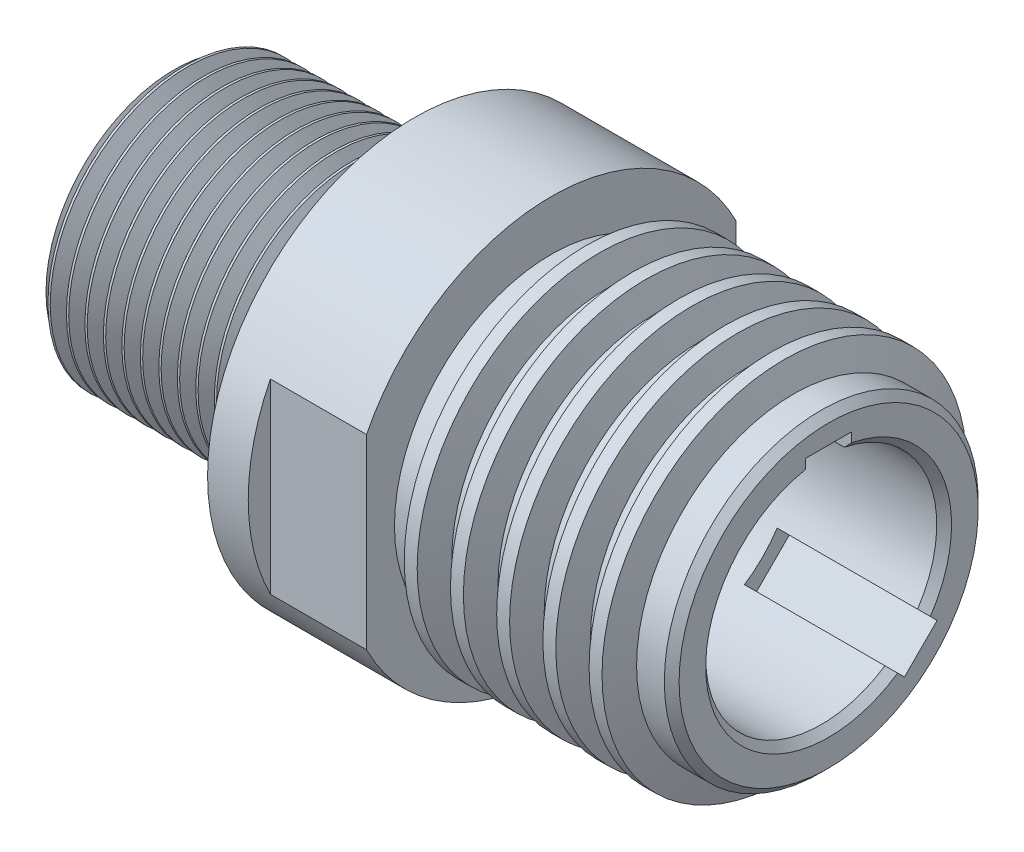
SolidWorks part; units mm, degrees
ref_plane "Front" through (0, 0, 0) normal (0, 0, 1) x (1, 0, 0)
ref_plane "Top" through (0, 0, 0) normal (0, 1, 0) x (1, 0, 0)
ref_plane "Right" through (0, 0, 0) normal (1, 0, 0) x (0, 0, -1)
sketch "Sketch1" plane through (0, 0, 0) normal (0, 0, 1) x (1, 0, 0)
  line L0 (0, 8.5725) -> (0.254, 8.5725)
  line L1 (0.254, 8.5725) -> (0.7526, 9.4361)
  line L2 (0.9113, 9.4361) -> (1.4099, 8.5725)
  line L3 (-0.8603, 0) -> (43.2496, 0) construction
  line L4 (1.4099, 8.5725) -> (1.524, 8.5725)
  line L5 (0.7526, 9.4361) -> (0.9113, 9.4361)
  line L6 (0, 8.5725) -> (0, 5.9724)
  line L7 (1.524, 8.5725) -> (2.0226, 9.4361)
  line L8 (2.0226, 9.4361) -> (2.1813, 9.4361)
  line L9 (2.1813, 9.4361) -> (2.6799, 8.5725)
  line L10 (2.6799, 8.5725) -> (2.794, 8.5725)
  line L11 (2.794, 8.5725) -> (3.2926, 9.4361)
  line L12 (3.2926, 9.4361) -> (3.4513, 9.4361)
  line L13 (3.4513, 9.4361) -> (3.9499, 8.5725)
  line L14 (3.9499, 8.5725) -> (4.064, 8.5725)
  line L15 (4.064, 8.5725) -> (4.5626, 9.4361)
  line L16 (4.5626, 9.4361) -> (4.7213, 9.4361)
  line L17 (4.7213, 9.4361) -> (5.2199, 8.5725)
  line L18 (5.2199, 8.5725) -> (5.334, 8.5725)
  line L19 (5.334, 8.5725) -> (5.8326, 9.4361)
  line L20 (5.8326, 9.4361) -> (5.9913, 9.4361)
  line L21 (5.9913, 9.4361) -> (6.4899, 8.5725)
  line L22 (6.4899, 8.5725) -> (6.604, 8.5725)
  line L23 (6.604, 8.5725) -> (7.1026, 9.4361)
  line L24 (7.1026, 9.4361) -> (7.2613, 9.4361)
  line L25 (7.2613, 9.4361) -> (7.7599, 8.5725)
  line L26 (7.7599, 8.5725) -> (7.874, 8.5725)
  line L27 (7.874, 8.5725) -> (8.3726, 9.4361)
  line L28 (8.3726, 9.4361) -> (8.5313, 9.4361)
  line L29 (8.5313, 9.4361) -> (9.0299, 8.5725)
  line L30 (9.0299, 8.5725) -> (9.144, 8.5725)
  line L31 (9.144, 8.5725) -> (9.6426, 9.4361)
  line L32 (9.6426, 9.4361) -> (9.8013, 9.4361)
  line L33 (9.8013, 9.4361) -> (10.2999, 8.5725)
  line L34 (10.2999, 8.5725) -> (10.414, 8.5725)
  line L35 (10.414, 8.5725) -> (10.9126, 9.4361)
  line L36 (10.9126, 9.4361) -> (11.0713, 9.4361)
  line L37 (11.0713, 9.4361) -> (11.5699, 8.5725)
  line L38 (11.5699, 8.5725) -> (11.684, 8.5725)
  line L39 (11.684, 8.5725) -> (12.1826, 9.4361)
  line L40 (12.1826, 9.4361) -> (12.3413, 9.4361)
  line L41 (12.3413, 9.4361) -> (12.8399, 8.5725)
  line L42 (12.8399, 8.5725) -> (12.954, 8.5725)
  line L43 (12.954, 8.5725) -> (13.4526, 9.4361)
  line L44 (13.4526, 9.4361) -> (13.6113, 9.4361)
  line L45 (13.6113, 9.4361) -> (14.1099, 8.5725)
  line L46 (14.1099, 8.5725) -> (14.224, 8.5725)
  line L47 (14.224, 8.5725) -> (14.7226, 9.4361)
  line L48 (14.7226, 9.4361) -> (14.8813, 9.4361)
  line L49 (14.8813, 9.4361) -> (15.3799, 8.5725)
  line L50 (15.3799, 8.5725) -> (15.494, 8.5725)
  line L51 (15.494, 8.5725) -> (15.9926, 9.4361)
  line L52 (15.9926, 9.4361) -> (16.1513, 9.4361)
  line L53 (16.1513, 9.4361) -> (16.6499, 8.5725)
  line L54 (16.6499, 8.5725) -> (16.764, 8.5725)
  line L55 (16.764, 8.5725) -> (17.2626, 9.4361)
  line L56 (17.2626, 9.4361) -> (17.4213, 9.4361)
  line L57 (17.4213, 9.4361) -> (17.9199, 8.5725)
  line L58 (17.9199, 8.5725) -> (18.034, 8.5725)
  line L59 (18.034, 8.5725) -> (18.5326, 9.4361)
  line L60 (18.5326, 9.4361) -> (18.6913, 9.4361)
  line L61 (18.6913, 9.4361) -> (19.1899, 8.5725)
  line L62 (19.1899, 8.5725) -> (19.304, 8.5725)
  line L63 (19.304, 8.5725) -> (19.8026, 9.4361)
  line L64 (19.8026, 9.4361) -> (19.9613, 9.4361)
  line L65 (19.9613, 9.4361) -> (20.4599, 8.5725)
  line L66 (20.4599, 8.5725) -> (20.574, 8.5725)
  line L67 (20.574, 8.5725) -> (21.0726, 9.4361)
  line L68 (21.0726, 9.4361) -> (21.2313, 9.4361)
  line L69 (21.2313, 9.4361) -> (21.7299, 8.5725)
  line L70 (21.7299, 8.5725) -> (21.844, 8.5725)
  line L71 (21.844, 8.5725) -> (25.4, 8.5725)
  line L72 (25.4, 8.5725) -> (25.4, 10.16)
  line L73 (25.4, 10.16) -> (27.0002, 10.16)
  line L74 (27.0002, 10.16) -> (27.0002, 11.9634)
  line L75 (27.0002, 11.9634) -> (25.4, 11.9634)
  line L76 (25.4, 11.9634) -> (25.4, 14.224)
  line L77 (25.4, 14.224) -> (34.798, 14.224)
  line L78 (34.798, 14.224) -> (34.798, 10.7823)
  line L79 (34.798, 10.7823) -> (36.576, 10.7823)
  line L80 (36.576, 10.7823) -> (37.211, 12.5222)
  line L81 (37.211, 12.5222) -> (38.1, 12.5222)
  line L82 (38.1, 12.5222) -> (38.735, 10.7823)
  line L83 (38.735, 10.7823) -> (39.751, 10.7823)
  line L84 (39.751, 10.7823) -> (40.386, 12.5222)
  line L85 (40.386, 12.5222) -> (41.275, 12.5222)
  line L86 (41.275, 12.5222) -> (41.91, 10.7823)
  line L87 (41.91, 10.7823) -> (42.926, 10.7823)
  line L88 (42.926, 10.7823) -> (43.561, 12.5222)
  line L89 (43.561, 12.5222) -> (44.45, 12.5222)
  line L90 (44.45, 12.5222) -> (45.085, 10.7823)
  line L91 (45.085, 10.7823) -> (46.101, 10.7823)
  line L92 (46.101, 10.7823) -> (46.736, 12.5222)
  line L93 (46.736, 12.5222) -> (47.625, 12.5222)
  line L94 (47.625, 12.5222) -> (48.26, 10.7823)
  line L95 (48.26, 10.7823) -> (49.276, 10.7823)
  line L96 (52.8895, 10.7823) -> (53.848, 10.7823)
  line L97 (53.848, 7.9375) -> (31.536, 7.9375)
  line L98 (49.276, 10.7823) -> (49.911, 12.5222)
  line L99 (49.911, 12.5222) -> (50.8, 12.5222)
  line L100 (50.8, 12.5222) -> (51.435, 10.7823)
  line L101 (51.435, 10.7823) -> (52.451, 10.7823)
  line L102 (52.451, 10.7823) -> (52.8895, 10.7823)
  line L103 (53.848, 10.7823) -> (53.848, 7.9375)
  line L104 (0, 5.9724) -> (31.536, 5.9724)
  line L105 (31.536, 5.9724) -> (31.536, 7.9375)
  line L106 (0, 0) -> (0, 2.7086) construction
  point P10 (0.832, 9.4361)
  point P11 (1.467, 8.5725)
  dimension "D1" = 60
  dimension "D2" = 120
  dimension "D3" = 0.1588
  dimension "D4" = 0.635
  dimension "D5" = 17.145
  dimension "D6" = 18.8722
  dimension "D7" = 0.254
  dimension "D8" = 25.4
  dimension "D9" = 20.32
  dimension "D10" = 23.9268
  dimension "D11" = 1.6002
  dimension "D12" = 28.448
  dimension "D13" = 9.398
  dimension "D14" = 21.5646
  dimension "D15" = 25.0444
  dimension "D16" = 3.175
  dimension "D17" = 1.778
  dimension "D18" = 1.016
  dimension "D19" = 15.875
  dimension "D20" = 0.889
  dimension "D21" = 53.848
  dimension "D22" = 2.413
revolve "Base-Revolve" add sketch "Sketch1" angle 360 about L3
sketch "Sketch3" plane through (34.798, 0, 0) normal (1, 0, 0) x (0, 0, -1)
  line L0 (-12.7, -18.5339) -> (12.7, 18.5339) construction
  line L1 (-12.7, 18.5339) -> (12.7, 18.5339)
  line L2 (-12.7, 18.5339) -> (-12.7, -18.5339)
  line L3 (-12.7, -18.5339) -> (12.7, -18.5339)
  line L4 (12.7, 18.5339) -> (12.7, -18.5339)
  dimension "D1" = 25.4
extrude "Cut-Extrude2" cut sketch "Sketch3" against normal blind 6.604 flip side to cut
chamfer "Chamfer1" distance 0.508 angle 45
sketch "Sketch4" plane through (53.848, 0, 0) normal (1, 0, 0) x (0, 0, -1)
  line L0 (0, 16.9449) -> (0, -15.8371) construction
  line L1 (-1.5875, 5.8705) -> (1.5875, 8.9535) construction
  line L2 (-1.5875, 8.9535) -> (1.5875, 8.9535)
  line L3 (-1.5875, 8.9535) -> (-1.5875, 5.8705)
  line L4 (-1.5875, 5.8705) -> (1.5875, 5.8705)
  line L5 (1.5875, 8.9535) -> (1.5875, 5.8705)
  line L6 (7.4536, -5.2085) -> (5.2085, -7.4536)
  line L7 (7.4536, -5.2085) -> (5.2736, -3.0286)
  line L8 (5.2736, -3.0286) -> (3.0286, -5.2736)
  line L9 (5.2085, -7.4536) -> (3.0286, -5.2736)
  line L10 (5.2736, -3.0286) -> (5.2085, -7.4536) construction
  circle A1 centre (0, 0) radius 7.9375 construction
  point P7 (0, 7.412)
  point P16 (5.2411, -5.2411)
  dimension "D2" = 1.016
  dimension "D1" = 3.175
extrude "Cut-Extrude3" cut sketch "Sketch4" against normal blind 10.16
sketch "Sketch5" plane through (0, 0, -12.7) normal (0, 0, -1) x (-1, 0, 0)
  line L0 (-8.89, -23.9586) -> (-8.89, 26.7544)
  line L1 (0, -8.5725) -> (0, 8.5725) construction
  dimension "D1" = 8.89
extrude "Cut-Extrude4" cut sketch "Sketch5" against normal through all and the other way through all flip side to cut
